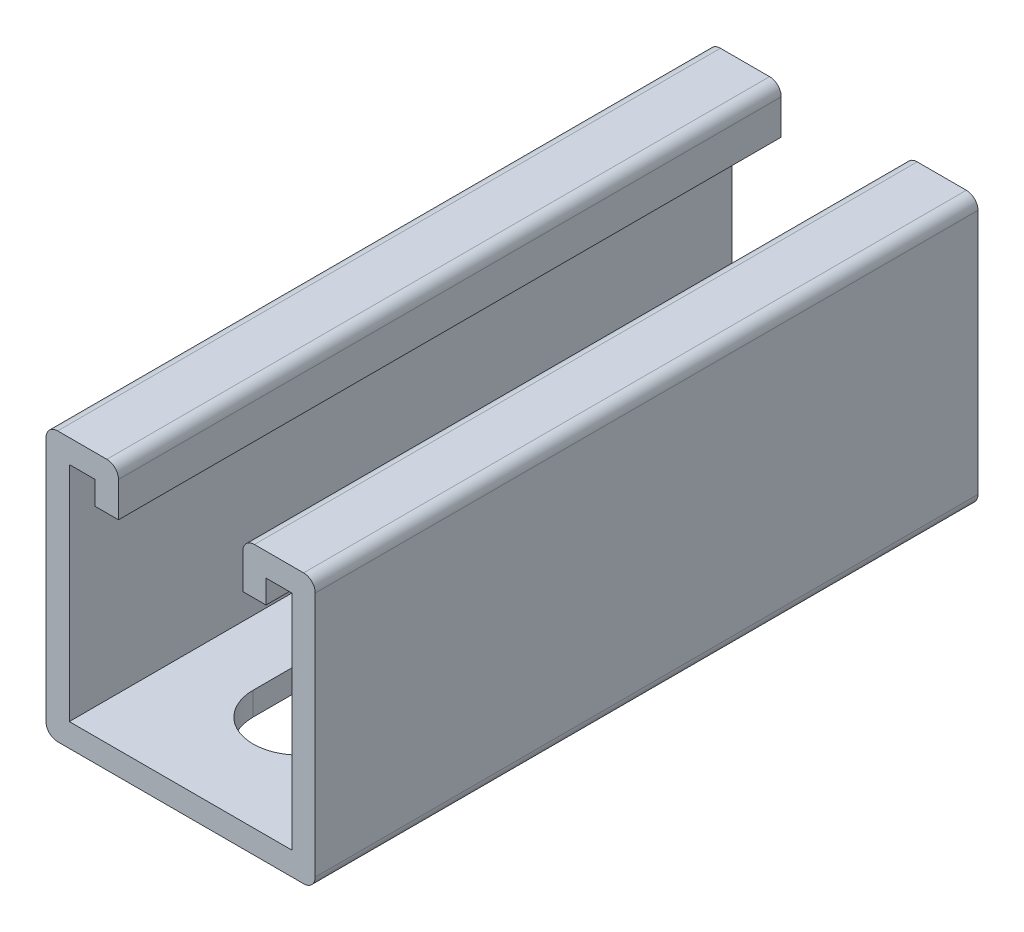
SolidWorks part; units mm, degrees
ref_plane "Plane1" through (0, 0, 0) normal (0, 0, 1) x (1, 0, 0)
ref_plane "Plane2" through (0, 0, 0) normal (0, 1, 0) x (1, 0, 0)
ref_plane "Plane3" through (0, 0, 0) normal (1, 0, 0) x (0, 0, -1)
sketch "Sketch1" plane through (0, 0, 0) normal (0, 0, 1) x (1, 0, 0)
  line L0 (-11.3109, 20.6375) -> (-18.8516, 20.6375)
  line L1 (-20.6375, 18.8516) -> (-20.6375, -18.8516)
  line L2 (-18.8516, -20.6375) -> (18.8516, -20.6375)
  line L3 (20.6375, -18.8516) -> (20.6375, 18.8516)
  line L4 (18.8516, 20.6375) -> (11.3109, 20.6375)
  line L5 (9.525, 18.8516) -> (9.525, 13.4938)
  line L6 (-9.525, 18.8516) -> (-9.525, 13.4938)
  line L7 (-13.0969, 17.0656) -> (-13.0969, 13.4938)
  line L8 (-13.0969, 17.0656) -> (-17.0656, 17.0656)
  line L9 (-17.0656, 17.0656) -> (-17.0656, -17.0656)
  line L10 (-17.0656, -17.0656) -> (17.0656, -17.0656)
  line L11 (17.0656, -17.0656) -> (17.0656, 17.0656)
  line L12 (17.0656, 17.0656) -> (13.0969, 17.0656)
  line L13 (13.0969, 17.0656) -> (13.0969, 13.4938)
  line L14 (-13.0969, 13.4938) -> (-9.525, 13.4938)
  line L15 (9.525, 13.4938) -> (13.0969, 13.4938)
  arc A0 (-11.3109, 20.6375) -> (-9.525, 18.8516) centre (-11.3109, 18.8516) cw
  arc A1 (-20.6375, 18.8516) -> (-18.8516, 20.6375) centre (-18.8516, 18.8516) cw
  arc A2 (-18.8516, -20.6375) -> (-20.6375, -18.8516) centre (-18.8516, -18.8516) cw
  arc A3 (20.6375, -18.8516) -> (18.8516, -20.6375) centre (18.8516, -18.8516) cw
  arc A4 (18.8516, 20.6375) -> (20.6375, 18.8516) centre (18.8516, 18.8516) cw
  arc A5 (9.525, 18.8516) -> (11.3109, 20.6375) centre (11.3109, 18.8516) cw
  dimension "D2" = 1.7859
  dimension "D3" = 20.6375
  dimension "Width" = 41.275
  dimension "D5" = 20.6375
  dimension "Height" = 41.275
  dimension "edge" = 11.1125
  dimension "D8" = 19.05
  dimension "ToeHt" = 7.1437
  dimension "gauge" = 3.5719
extrude "Base-Extrude" add sketch "Sketch1" along normal blind 101.6
sketch "Sketch2" plane through (0, -20.6375, 0) normal (0, -1, 0) x (1, 0, 0)
  line L0 (7.1437, 32.5438) -> (7.1437, 18.2562)
  line L1 (-7.1437, 18.2562) -> (-7.1437, 32.5438)
  arc A0 (-7.1437, 18.2562) -> (7.1437, 18.2562) centre (0, 18.2562) ccw
  arc A1 (7.1437, 32.5438) -> (-7.1437, 32.5438) centre (0, 32.5438) ccw
  dimension "D3" = 14.2875
  dimension "D1" = 18.2562
  dimension "D2" = 14.2875
extrude "Slot" cut sketch "Sketch2" against normal through all
pattern_linear "LPattern1" count 2 spacing 50.8 along (0, 0, 1) of "Slot"
equation "\"D5@Sketch1\" = \"Height@Sketch1\" / 2"
equation "\"D3@Sketch1\" = \"Width@Sketch1\" / 2"
equation "\"D2@Sketch1\" = \"gauge@Sketch1\" / 2"
equation "\"D8@Sketch1\" = \"Width@Sketch1\" - 2 * \"edge@Sketch1\""
equation "\"gauge@Sketch1\" = \"ToeHt@Sketch1\" / 2"
equation "\"D1@LPattern1\" = \"D1@Base-Extrude\" / \"D3@LPattern1\""
